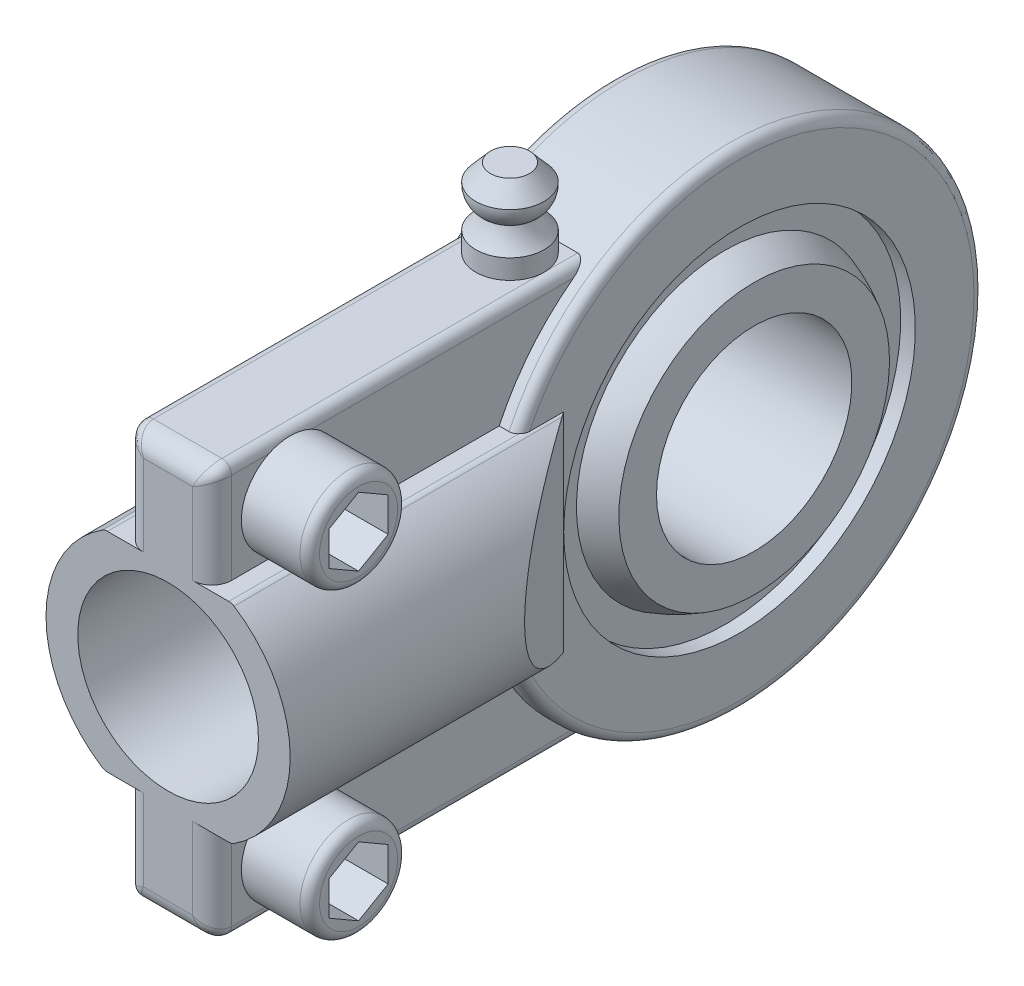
SolidWorks part; units mm, degrees
ref_plane "Face" through (0, 0, 0) normal (0, 0, 1) x (1, 0, 0)
ref_plane "Dessus" through (0, 0, 0) normal (0, 1, 0) x (1, 0, 0)
ref_plane "Droite" through (0, 0, 0) normal (1, 0, 0) x (0, 0, -1)
sketch "Esquisse1" plane through (0, 0, 0) normal (0, 0, 1) x (1, 0, 0)
  line L0 (0, 0) -> (74.4143, 0) construction
  line L1 (-6.5, 25) -> (6.5, 25)
  line L2 (-8, 10) -> (8, 10)
  line L3 (8, 13.8564) -> (8, 10)
  line L4 (-8, 13.8564) -> (-8, 10)
  line L5 (21.6506, 10) -> (21.7386, 10)
  line L6 (6.5, 25) -> (6.5, 18)
  line L7 (-6.5, 25) -> (-6.5, 18)
  line L8 (6.5, 18) -> (5, 18)
  line L9 (5, 18) -> (5, 15.1987)
  line L10 (-6.5, 18) -> (-5, 18)
  line L11 (-5, 18) -> (-5, 15.1987)
  arc A0 (-5, 15.1987) -> (-8, 13.8564) centre (0, 0) ccw
  arc A1 (8, 13.8564) -> (5, 15.1987) centre (0, 0) ccw
  point P6 (0, 25)
  point P14 (0, 10)
  dimension "D1" = 50
  dimension "D2" = 20
  dimension "D3" = 16
  dimension "D4" = 16
  dimension "D6" = 13
  dimension "D8" = 1.5
  dimension "D9" = 1.5
  dimension "D10" = 7
revolve "Révolution1" add sketch "Esquisse1" angle 360 about L0
ref_plane "Plan1" through (0, 0, 52) normal (0, 0, 1) x (1, 0, 0)
sketch "Esquisse2" plane through (0, 0, 52) normal (0, 0, 1) x (1, 0, 0)
  line L1 (-6.5, 21) -> (6.5, 21)
  line L2 (-6.5, 21) -> (-6.5, -21)
  line L3 (-6.5, -21) -> (6.5, -21)
  line L4 (6.5, 21) -> (6.5, -21)
  line L6 (6.5, -25) -> (6.5, 25) construction
  line L7 (-6.5, 25) -> (-6.5, -25) construction
  dimension "D1" = 42
  dimension "D2" = 21
sketch "Esquisse3" plane through (0, 0, 52) normal (0, 0, 1) x (1, 0, 0)
  line L2 (-6.5, 10.6771) -> (-6.5, -10.6771)
  line L3 (6.5, -10.6771) -> (6.5, 10.6771)
  line L4 (-6.5, 25) -> (-6.5, -25) construction
  line L5 (6.5, -25) -> (6.5, 25) construction
  arc A0 (-6.5, 10.6771) -> (-6.5, -10.6771) centre (0, 0) ccw
  arc A1 (6.5, -10.6771) -> (6.5, 10.6771) centre (0, 0) ccw
  dimension "D1" = 25
extrude "Extrusion1" add sketch "Esquisse2" against normal up to surface (38.4353 mm away)
extrude "Extrusion2" add sketch "Esquisse3" against normal blind 34
sketch "Esquisse7" plane through (6.5, 0, 0) normal (1, 0, 0) x (0, 0, -1)
  line L0 (0, 0) -> (-7.408, 0) construction
  line L1 (-52, 10.6771) -> (-22.6053, 10.6771)
  line L2 (-52, 21) -> (-52, 10.6771)
  line L3 (-13.5647, -21) -> (-52, -21)
  line L4 (-52, -21) -> (-52, -10.6771)
  line L5 (-52, -10.6771) -> (-22.6053, -10.6771)
  line L6 (-18, -10.6771) -> (-52, -10.6771) construction
  line L7 (-13.5647, 21) -> (-52, 21)
  arc A0 (-22.6053, -10.6771) -> (-13.5647, -21) centre (0, 0) ccw
  arc A1 (-22.6053, 10.6771) -> (-13.5647, 21) centre (0, 0) cw
extrude "Enlèv. mat.-Extru.2" cut sketch "Esquisse7" against normal blind 2
sketch "Esquisse4" plane through (0, 0, 0) normal (0, 1, 0) x (1, 0, 0)
  line L0 (6.5, -18) -> (12.5, -28)
  line L2 (12.5, -28) -> (12.5, -18)
  line L3 (12.5, -18) -> (6.5, -18)
  line L4 (-6.5, -18) -> (-12.5, -18)
  line L6 (-6.5, -18) -> (-12.5, -28)
  line L7 (-12.5, -18) -> (-12.5, -28)
  line L9 (-12.5, -18) -> (-12.5, -52) construction
  line L10 (-6.5, -18) -> (-12.5, -18) construction
  line L11 (12.5, -18) -> (6.5, -18) construction
  line L12 (12.5, -52) -> (12.5, -18) construction
  dimension "D1" = 10
  dimension "D2" = 10
extrude "Enlèv. mat.-Extru.1" cut sketch "Esquisse4" against normal through all and the other way through all
hole_wizard "Trou taraudé M20x1.51" positions "Esquisse6" profile "Esquisse5" tap size "M20x1.5" standard "ISO"
sketch "Esquisse6" plane through (0, 0, 52) normal (0, 0, 1) x (1, 0, 0)
  arc A0 (-6.5, 10.6771) -> (-6.5, -10.6771) centre (0, 0) ccw construction
  point P0 (0, 0)
sketch "Esquisse5" plane through (0, 0, 52) normal (1, 0, 0) x (0, -1, 0)
  line L0 (0, 0) -> (0, 33.058)
  line L1 (0, 33.058) -> (9.25, 27.5)
  line L2 (9.25, 27.5) -> (9.25, 0)
  line L5 (9.25, 0) -> (0, 0)
  line L10 (0, 33.058) -> (-9.25, 27.5) construction
  line L11 (0, -6.35) -> (0, 107.95) construction
  dimension "Diamètre du trou pour taraudage" = 18.5
  dimension "Profondeur du trou pour taraudage" = 27.5
  dimension "Angle de pointe" = 118
mirror "Symétrie1" about plane through (0, 0, 0) normal (1, 0, 0) of "Enlèv. mat.-Extru.2"
fillet "Congé1" radius 1 12 edges at (-4.5, -21, 32.7823) (4.5, -21, 32.7823) (-4.5, 21, 32.7823) (4.5, 21, 32.7823) (-6.5, 10.6771, 37.3027) (-6.5, -10.6771, 37.3027) (6.5, 10.6771, 37.3027) (6.5, -10.6771, 37.3027) (-6.5, 0, -25) (-6.5, -10.6771, 20.3027) (-6.5, 10.6771, 20.3027) (6.5, 0, -25)
fillet "Congé2" radius 2 10 edges at (-4.5, -15.3385, 52) (-4.2071, -20.7071, 52) (4.5, -15.3385, 52) (4.2071, -20.7071, 52) (4.5, 15.3385, 52) (4.2071, 20.7071, 52) (-4.5, 15.3385, 52) (-4.2071, 20.7071, 52) (0, -21, 52) (0, 21, 52)
sketch "Esquisse8" plane through (4.5, 0, 0) normal (1, 0, 0) x (0, 0, -1)
  line L0 (-52, 10.6771) -> (-52, 19) construction
  circle A0 centre (-44, 15.5) radius 5
  dimension "D1" = 10
  dimension "D2" = 15.5
  dimension "D3" = 8
extrude "Extrusion3" add sketch "Esquisse8" along normal blind 7
fillet "Congé3" radius 1 1 edges at (11.5, 15.5, 39)
sketch "Esquisse9" plane through (11.5, 0, 0) normal (1, 0, 0) x (0, 0, -1)
  line L0 (-44, 19) -> (-44, 12) construction
  line L1 (-39, 15.5) -> (-53.8475, 15.5) construction
  line L2 (-44, 19) -> (-40.9689, 17.25)
  line L3 (-40.9689, 17.25) -> (-40.9689, 13.75)
  line L4 (-47.0311, 17.25) -> (-47.0311, 13.75)
  line L5 (-44, 19) -> (-47.0311, 17.25)
  line L6 (-44, 12) -> (-47.0311, 13.75)
  line L7 (-44, 12) -> (-40.9689, 13.75)
  line L8 (-52, 10.6771) -> (-52, 19) construction
  circle A0 centre (-44, 15.5) radius 5 construction
  point P15 (-47.0311, 15.5)
  point P16 (-40.9689, 15.5)
  dimension "D1" = 3.5
  dimension "D2" = 3.5
  dimension "D3" = 7
  dimension "D4" = 8
  dimension "D5" = 3.5
  dimension "D6" = 3.5
extrude "Enlèv. mat.-Extru.3" cut sketch "Esquisse9" against normal blind 5
mirror "Symétrie2" about plane through (0, 0, 0) normal (0, 1, 0) of "Enlèv. mat.-Extru.3", "Congé3", "Extrusion3"
ref_plane "Plan2" through (0, 0, 17) normal (0, 0, 1) x (1, 0, 0)
sketch "Esquisse10" plane through (0, 0, 17) normal (0, 0, 1) x (1, 0, 0)
  line L0 (0, 0) -> (0, 32.5167) construction
  line L1 (0, 21) -> (3.5, 21)
  line L3 (3.5, 21) -> (3.5, 23)
  line L4 (2, 29) -> (0, 29)
  line L5 (0, 29) -> (0, 21)
  line L6 (2, 29) -> (3.5, 27.2756)
  line L8 (-3.5, 21) -> (3.5, 21) construction
  arc A0 (3.5, 23) -> (2.309, 25.024) centre (7.4676, 26.6972) cw
  arc A1 (2.309, 25.024) -> (3.5, 27.2756) centre (0.9987, 27.1579) ccw
  dimension "D1" = 8
  dimension "D2" = 2
  dimension "D3" = 2
  dimension "D4" = 3.5
revolve "Révolution2" add sketch "Esquisse10" angle 360 about L0
